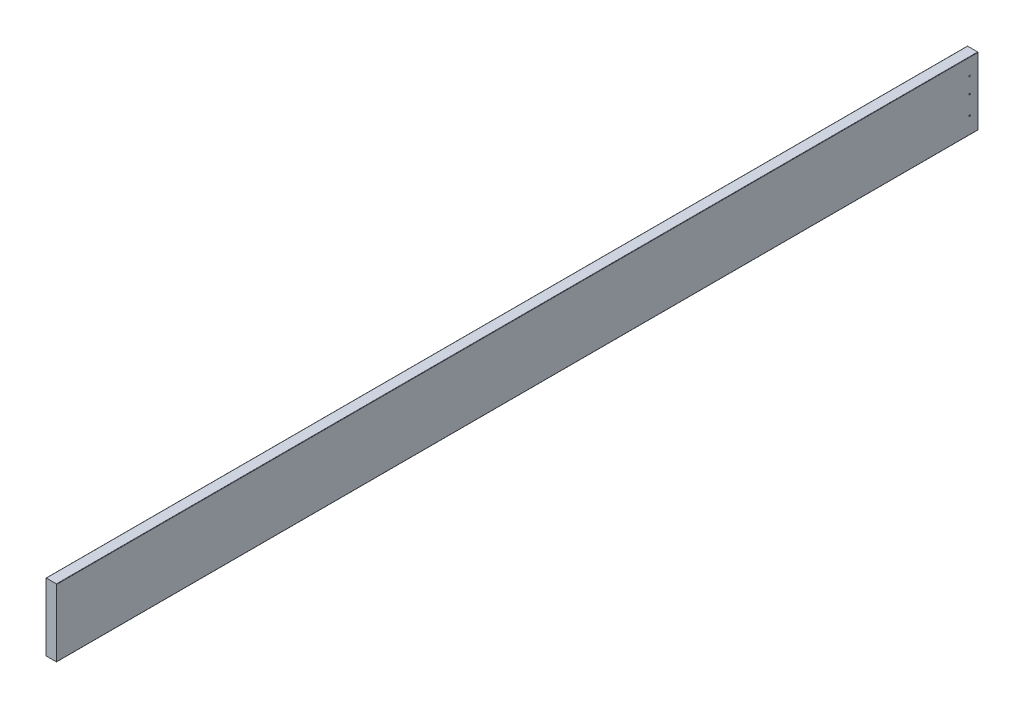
SolidWorks part; units mm, degrees
ref_plane "Front" through (0, 0, 0) normal (0, 0, 1) x (1, 0, 0)
ref_plane "Top" through (0, 0, 0) normal (0, 1, 0) x (1, 0, 0)
ref_plane "Right" through (0, 0, 0) normal (1, 0, 0) x (0, 0, -1)
sketch "Sketch1" plane through (0, 0, 0) normal (0, 0, 1) x (1, 0, 0)
  line L1 (-19.05, -120.65) -> (19.05, -120.65)
  line L2 (-19.05, -120.65) -> (-19.05, 120.65)
  line L3 (-19.05, 120.65) -> (19.05, 120.65)
  line L4 (19.05, -120.65) -> (19.05, 120.65)
  line L5 (-19.05, -120.65) -> (19.05, 120.65) construction
  line L6 (-19.05, 120.65) -> (19.05, -120.65) construction
  point P0 (0, 0)
  dimension "D1" = 241.3
  dimension "D2" = 38.1
extrude "Extrude1" add sketch "Sketch1" along normal blind 3289.3
fillet "Fillet1" radius 1.27 4 edges at (-19.05, -120.65, 1644.65) (19.05, -120.65, 1644.65) (19.05, 120.65, 1644.65) (-19.05, 120.65, 1644.65)
sketch "Sketch2" plane through (19.05, 0, 0) normal (1, 0, 0) x (0, 0, -1)
  line L0 (0, -119.38) -> (0, 119.38) construction
  line L1 (-3289.3, -119.38) -> (0, -119.38) construction
  circle A3 centre (-30, -60.8542) radius 2.5
  circle A4 centre (-30, 5.3958) radius 2.5
  circle A5 centre (-30, 61.6458) radius 2.5
  dimension "D1" = 5
  dimension "D2" = 30
  dimension "D3" = 58.5258
  dimension "D4" = 124.7758
  dimension "D5" = 181.0258
extrude "Cut-Extrude1" cut sketch "Sketch2" against normal blind 17.78
sketch "Sketch3" plane through (-19.05, 0, 0) normal (-1, 0, 0) x (0, 0, 1)
  line L0 (0, 119.38) -> (0, -119.38) construction
  line L1 (0, -119.38) -> (3289.3, -119.38) construction
  circle A3 centre (30, -60.8542) radius 2.5
  circle A4 centre (30, 5.3958) radius 2.5
  circle A5 centre (30, 61.6458) radius 2.5
  dimension "D1" = 5
  dimension "D2" = 30
  dimension "D3" = 59.7958
  dimension "D4" = 126.0458
  dimension "D5" = 182.2958
extrude "Cut-Extrude2" cut sketch "Sketch3" against normal blind 17.78
